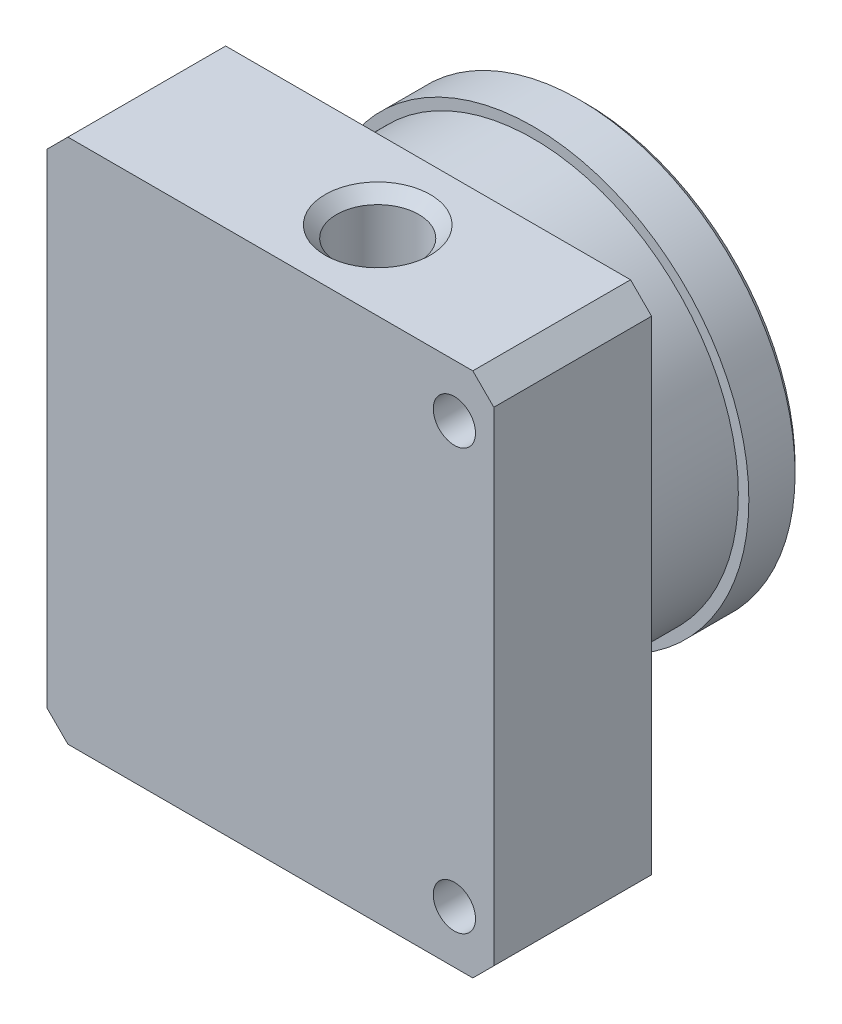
SolidWorks part; units mm, degrees
ref_plane "Front" through (0, 0, 0) normal (0, 0, 1) x (1, 0, 0)
ref_plane "Top" through (0, 0, 0) normal (0, 1, 0) x (1, 0, 0)
ref_plane "Right" through (0, 0, 0) normal (1, 0, 0) x (0, 0, -1)
sketch "Sketch1" plane through (0, 0, 0) normal (0, 0, 1) x (1, 0, 0)
  line L0 (0, 31.75) -> (0, 19.8178) construction
  line L1 (-26.9875, 31.75) -> (26.9875, 31.75)
  line L2 (-26.9875, 31.75) -> (-26.9875, -31.75)
  line L3 (26.9875, 0) -> (-38.3033, 0) construction
  line L4 (26.9875, 31.75) -> (26.9875, -31.75)
  line L5 (26.9875, -31.75) -> (-26.9875, -31.75)
  dimension "D3" = 53.975
  dimension "D4" = 63.5
extrude "body" add sketch "Sketch1" along normal blind 19.05
ref_plane "Plane2" through (0, 0, 127) normal (-1, 0, 0) x (0, 1, 0)
ref_plane "Plane3" through (0, 0, 7.62) normal (-1, 0, 0) x (0, 1, 0)
sketch "Sketch17" plane through (0, 0, 0) normal (0, 0, -1) x (-1, 0, 0)
  line L0 (0, 28.3788) -> (0, -28.9833) construction
  line L1 (-29.1472, 14.8602) -> (26.0591, -10.8829) construction
  line L2 (0, 0) -> (-16.1729, 0) construction
  circle A0 centre (-3.4405, 2.8729) radius 2
  circle A1 centre (3.81, -0.508) radius 2
  dimension "D1" = 8
  dimension "D2" = 25
  dimension "D3" = 4
  dimension "D4" = 3.81
  dimension "D6" = 4
  dimension "D5" = 0.508
extrude "internal pump ports" cut sketch "Sketch17" against normal blind 9.525
sketch "Sketch21" plane through (0, 0, 0) normal (0, 0, -1) x (-1, 0, 0)
  line L0 (0, 31.75) -> (0, -17.3751) construction
  line L1 (-26.9875, 31.75) -> (26.9875, 31.75) construction
  circle A2 centre (0, 3.175) radius 22.225
  circle A3 centre (0, 3.175) radius 26.035
  dimension "D1" = 44.45
  dimension "D2" = 28.575
  dimension "D3" = 52.07
extrude "mocap boss" add sketch "Sketch21" along normal blind 19.05
chamfer "Chamfer5" distance 0.762 angle 45 2 edges at (-22.225, 3.175, -19.05) (-26.035, 3.175, -19.05)
sketch "Sketch22" plane through (0, 0, 0) normal (0, 0, -1) x (-1, 0, 0)
  circle A1 centre (0, 3.175) radius 22.225 construction
  circle A2 centre (0, 3.175) radius 22.225
  dimension "D1" = 44.45
extrude "pump pocket" cut sketch "Sketch22" against normal blind 1.27
chamfer "block corners" distance 2.54 angle 45 4 edges at (-26.9875, -31.75, 9.525) (26.9875, -31.75, 9.525) (26.9875, 31.75, 9.525) (-26.9875, 31.75, 9.525)
sketch "Sketch24" plane through (0, 0, 1.27) normal (0, 0, -1) x (-1, 0, 0)
  line L0 (-15.8623, -1.27) -> (-8.382, -1.27)
  line L2 (-5.08, -4.572) -> (-5.08, -5.842)
  line L3 (-1.778, -9.144) -> (0.762, -9.144)
  line L4 (4.064, -12.446) -> (4.064, -14.4615)
  arc A1 (-5.08, -4.572) -> (-8.382, -1.27) centre (-8.382, -4.572) ccw
  circle A3 centre (0, 3.175) radius 20.955
  arc A4 (-18.8293, -6.0211) -> (0.9045, -17.7605) centre (0, 3.175) ccw
  arc A5 (-15.8623, -1.27) -> (-18.8293, -6.0211) centre (-15.8623, -4.572) ccw
  arc A6 (0.9045, -17.7605) -> (4.064, -14.4615) centre (0.762, -14.4615) ccw
  arc A7 (4.064, -12.446) -> (0.762, -9.144) centre (0.762, -12.446) ccw
  arc A8 (-5.08, -5.842) -> (-1.778, -9.144) centre (-1.778, -5.842) ccw
  dimension "D1" = 1.27
  dimension "D2" = 3.302
  dimension "D3" = 3.302
  dimension "D4" = 1.27
  dimension "D5" = 5.08
  dimension "D6" = 9.144
  dimension "D7" = 4.064
extrude "internal wire pocket" cut sketch "Sketch24" against normal blind 10.16
sketch "Sketch25" plane through (0, 0, 0) normal (0, 0, -1) x (-1, 0, 0)
  line L0 (-43.253, 25.4) -> (-12.0506, 25.4) construction
  line L1 (-47.2254, -25.4) -> (-14.6225, -25.4) construction
  line L2 (-22.225, 41.4004) -> (-22.225, -42.5176) construction
  circle A1 centre (-22.225, 25.4) radius 2.5527
  circle A3 centre (-22.225, -25.4) radius 2.5527
  dimension "D1" = 22.225
  dimension "D5" = 5.1054
  dimension "D7" = 5.1054
  dimension "D2" = 25.4
  dimension "D3" = 50.8
extrude "mounting holes" cut sketch "Sketch25" against normal through all
ref_plane "Plane4" through (4.953, 14.732, 25.3746) normal (-1, 0, 0) x (0, -1, 0)
ref_plane "Plane5" through (4.953, 14.732, 25.3746) normal (-1, 0, 0) x (0, -1, 0)
ref_axis "Axis1" through (0, 3.175, -55.7553) along (0, 0, 1)
sketch "Sketch31" plane through (0, 0, 0) normal (1, 0, 0) x (0, 0, -1)
  line L0 (18.288, 29.21) -> (0, 29.21) construction
  line L1 (0, 29.21) -> (12.7, 29.21)
  line L2 (0, 29.21) -> (0, 27.94)
  line L3 (0, 27.94) -> (12.7, 27.94)
  line L4 (12.7, 29.21) -> (12.7, 27.94)
  line L6 (19.05, -22.098) -> (19.05, 28.448) construction
  dimension "D1" = 1.27
  dimension "D2" = 6.35
revolve "clamping groove" cut sketch "Sketch31" angle 360 about axis through (0, 3.175, -55.7553) along (0, 0, 1)
hole_wizard "7/16-20 Tapped Hole1 outlet port" positions "Sketch34" profile "Sketch33" tap size "7/16-20" standard "ANSI Inch"
sketch "Sketch34" plane through (-26.9875, 0, 0) normal (-1, 0, 0) x (0, 0, 1)
  line L0 (9.525, 1.492) -> (9.525, -2.508) construction
  line L2 (0, 29.21) -> (0, -29.21) construction
  point P33 (9.525, -0.508)
  point P61 (0, 0)
  dimension "D1" = 0.508
sketch "Sketch33" plane through (-26.9875, -0.508, 9.525) normal (0, 1, 0) x (0, 0, 1)
  line L0 (0, 0) -> (0, 15.6806)
  line L1 (0, 15.6806) -> (4.9606, 12.7)
  line L2 (4.9606, 12.7) -> (4.9606, 1.3894)
  line L3 (4.9606, 1.3894) -> (6.35, 0)
  line L5 (6.35, 0) -> (0, 0)
  line L6 (-4.9606, 1.3894) -> (-6.35, 0) construction
  line L10 (0, 15.6806) -> (-4.9606, 12.7) construction
  line L11 (0, -6.35) -> (0, 107.95) construction
  dimension "Tap Drill Dia." = 9.9212
  dimension "Tap Drill Depth" = 12.7
  dimension "Near C'Sink Dia." = 12.7
  dimension "Near C'Sink Angle" = 90
  dimension "Drill Angle" = 118
hole_wizard "7/16-20 Tapped Hole2 inlet port" positions "Sketch36" profile "Sketch35" tap size "7/16-20" standard "ANSI Inch"
sketch "Sketch36" plane through (0, 31.75, 0) normal (0, 1, 0) x (-1, 0, 0)
  line L0 (-26.9875, 9.525) -> (28.9134, 9.525) construction
  line L1 (-26.9875, 0) -> (-26.9875, 19.05) construction
  line L2 (-5.4405, 9.525) -> (-1.4405, 9.525) construction
  point P8 (-3.4405, 9.525)
sketch "Sketch35" plane through (3.4405, 31.75, 9.525) normal (1, 0, 0) x (0, 0, 1)
  line L0 (0, 0) -> (0, 18.2206)
  line L1 (0, 18.2206) -> (4.9606, 15.24)
  line L2 (4.9606, 15.24) -> (4.9606, 1.3894)
  line L3 (4.9606, 1.3894) -> (6.35, 0)
  line L5 (6.35, 0) -> (0, 0)
  line L6 (-4.9606, 1.3894) -> (-6.35, 0) construction
  line L10 (0, 18.2206) -> (-4.9606, 15.24) construction
  line L11 (0, -6.35) -> (0, 107.95) construction
  dimension "Tap Drill Dia." = 9.9212
  dimension "Tap Drill Depth" = 15.24
  dimension "Near C'Sink Dia." = 12.7
  dimension "Near C'Sink Angle" = 90
  dimension "Drill Angle" = 118
chamfer "Chamfer7" distance 0.508 angle 45 2 edges at (-5.81, -0.508, 1.27) (1.4405, 2.8729, 1.27)
hole_wizard "#7 (0.201) inlet port flow path" positions "Sketch39" profile "Sketch38" hole size "#11" standard "ANSI Inch"
sketch "Sketch39" plane through (0, 31.75, 0) normal (0, 1, 0) x (1, 0, 0)
  point P0 (3.4405, -9.525)
sketch "Sketch38" plane through (3.4405, 31.75, 9.525) normal (1, 0, 0) x (0, 0, 1)
  line L0 (0, 0) -> (0, 33.5377)
  line L1 (0, 33.5377) -> (2.4257, 32.0802)
  line L2 (2.4257, 32.0802) -> (2.4257, 0)
  line L5 (2.4257, 0) -> (0, 0)
  line L10 (0, 33.5377) -> (-2.4257, 32.0802) construction
  line L11 (0, -6.35) -> (0, 107.95) construction
  dimension "Hole Dia." = 4.8514
  dimension "Hole Depth" = 32.0802
  dimension "Drill Angle" = 118
hole_wizard "#4-40 Tapped Hole1 pump mount" positions "Sketch42" profile "Sketch41" tap size "#4-40" standard "ANSI Inch"
sketch "Sketch42" plane through (0, 0, 1.27) normal (0, 0, -1) x (-1, 0, 0)
  line L0 (-2.8029, -5.2246) -> (0.1848, 1.1825) construction
  line L3 (-3.4405, 2.8729) -> (3.81, -0.508) construction
  point P14 (-11.1394, 11.2076)
  point P16 (10.6027, -8.42)
  dimension "D1" = 14.5
  dimension "D2" = 13.5
  dimension "D3" = 4.3
  dimension "D4" = 4.3
sketch "Sketch41" plane through (11.1394, 11.2076, 1.27) normal (1, 0, 0) x (0, 1, 0)
  line L0 (0, 0) -> (0, 9.5438)
  line L1 (0, 9.5438) -> (1.1303, 8.8646)
  line L2 (1.1303, 8.8646) -> (1.1303, 0.9271)
  line L3 (1.1303, 0.9271) -> (2.0574, 0)
  line L5 (2.0574, 0) -> (0, 0)
  line L6 (-1.1303, 0.9271) -> (-2.0574, 0) construction
  line L10 (0, 9.5438) -> (-1.1303, 8.8646) construction
  line L11 (0, -6.35) -> (0, 107.95) construction
  dimension "Tap Drill Dia." = 2.2606
  dimension "Tap Drill Depth" = 8.8646
  dimension "Near C'Sink Dia." = 4.1148
  dimension "Near C'Sink Angle" = 90
  dimension "Drill Angle" = 118
hole_wizard "7/16-20 Tapped Hole3 MCBH hole" positions "Sketch47" profile "Sketch46" tap size "7/16-20" standard "ANSI Inch"
sketch "Sketch47" plane through (0, -31.75, 0) normal (0, -1, 0) x (-1, 0, 0)
  line L0 (-26.9875, -9.525) -> (30.7608, -9.525) construction
  line L1 (-26.9875, -19.05) -> (-26.9875, 0) construction
  line L2 (-24.4475, 0) -> (24.4475, 0) construction
  point P7 (-9.525, -9.525)
  point P10 (0, 0)
  dimension "D1" = 9.525
sketch "Sketch46" plane through (9.525, -31.75, 9.525) normal (1, 0, 0) x (0, 0, -1)
  line L0 (0, 0) -> (0, 28.3806)
  line L1 (0, 28.3806) -> (4.9606, 25.4)
  line L2 (4.9606, 25.4) -> (4.9606, 1.3894)
  line L3 (4.9606, 1.3894) -> (6.35, 0)
  line L5 (6.35, 0) -> (0, 0)
  line L6 (-4.9606, 1.3894) -> (-6.35, 0) construction
  line L10 (0, 28.3806) -> (-4.9606, 25.4) construction
  line L11 (0, -6.35) -> (0, 107.95) construction
  dimension "Tap Drill Dia." = 9.9212
  dimension "Tap Drill Depth" = 25.4
  dimension "Near C'Sink Dia." = 12.7
  dimension "Near C'Sink Angle" = 90
  dimension "Drill Angle" = 118
hole_wizard "I (0.272) Diameter lure comp Hole2" positions "Sketch52" profile "Sketch51" hole size "I" standard "ANSI Inch"
sketch "Sketch52" plane through (-26.9875, 0, 0) normal (-1, 0, 0) x (0, 0, 1)
  line L0 (9.525, -29.21) -> (9.525, 2.0019) construction
  line L1 (0, -29.21) -> (19.05, -29.21) construction
  line L3 (32.6093, 1.1063) -> (32.7147, 1.1063) construction
  line L4 (0, 29.21) -> (0, -29.21) construction
  point P9 (9.525, -17.78)
  point P12 (0, 0)
  dimension "D1" = 17.78
sketch "Sketch51" plane through (-26.9875, -17.78, 9.525) normal (0, 1, 0) x (0, 0, 1)
  line L0 (0, 0) -> (0, 28.7456)
  line L1 (0, 28.7456) -> (3.4544, 26.67)
  line L2 (3.4544, 26.67) -> (3.4544, 0)
  line L5 (3.4544, 0) -> (0, 0)
  line L10 (0, 28.7456) -> (-3.4544, 26.67) construction
  line L11 (0, -6.35) -> (0, 107.95) construction
  dimension "Hole Dia." = 6.9088
  dimension "Hole Depth" = 26.67
  dimension "Drill Angle" = 118
hole_wizard "#11 (0.191) outlet flow path" positions "Sketch54" profile "Sketch53" hole size "#11" standard "ANSI Inch"
sketch "Sketch54" plane through (-26.9875, 0, 0) normal (-1, 0, 0) x (0, 0, 1)
  point P0 (9.525, -0.508)
sketch "Sketch53" plane through (-26.9875, -0.508, 9.525) normal (0, 1, 0) x (0, 0, 1)
  line L0 (0, 0) -> (0, 25.9177)
  line L1 (0, 25.9177) -> (2.4257, 24.4602)
  line L2 (2.4257, 24.4602) -> (2.4257, 0)
  line L5 (2.4257, 0) -> (0, 0)
  line L10 (0, 25.9177) -> (-2.4257, 24.4602) construction
  line L11 (0, -6.35) -> (0, 107.95) construction
  dimension "Hole Dia." = 4.8514
  dimension "Hole Depth" = 24.4602
  dimension "Drill Angle" = 118
